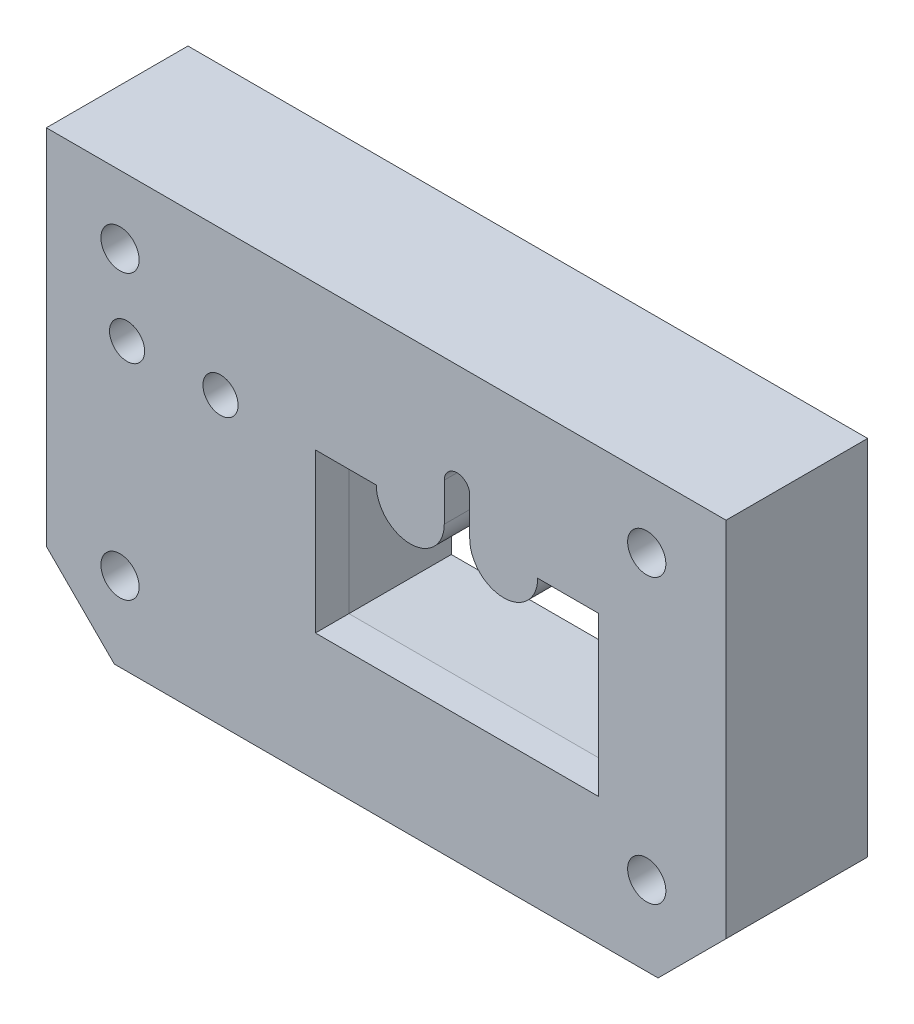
SolidWorks part; units mm, degrees
ref_plane "Face" through (0, 0, 0) normal (0, 0, 1) x (1, 0, 0)
ref_plane "Dessus" through (0, 0, 0) normal (0, 1, 0) x (1, 0, 0)
ref_plane "Droite" through (0, 0, 0) normal (1, 0, 0) x (0, 0, -1)
mirrored part "Matrice rapportée droite_Rendre symétrique"
other "<MATRICE RAPPORTÉE DROITE>-<Enlèv. mat.-Extru.4>"
